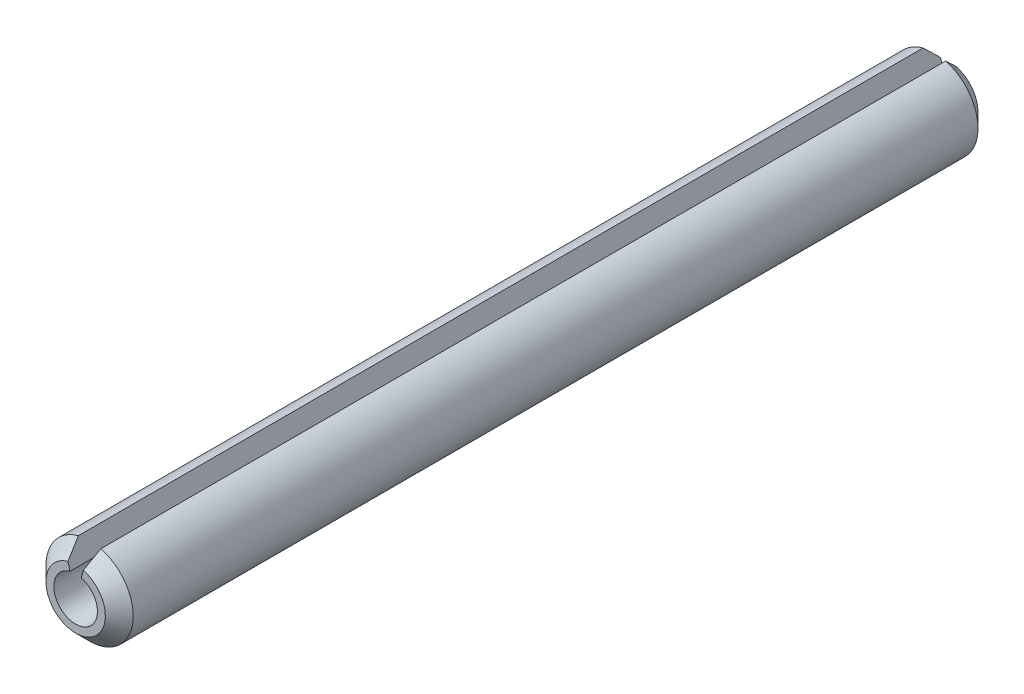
SolidWorks part; units mm, degrees
ref_plane "Front Plane" through (0, 0, 0) normal (0, 0, 1) x (1, 0, 0)
ref_plane "Top Plane" through (0, 0, 0) normal (0, 1, 0) x (1, 0, 0)
ref_plane "Right Plane" through (0, 0, 0) normal (1, 0, 0) x (0, 0, -1)
sketch "Sketch1" plane through (0, 0, 0) normal (0, 0, 1) x (1, 0, 0)
  line L0 (0.2054, 0.7667) -> (0.4109, 1.5334)
  line L1 (-0.2054, 0.7667) -> (-0.4109, 1.5334)
  line L2 (0, 0) -> (0, 2.5064) construction
  arc A0 (-0.4109, 1.5334) -> (0.4109, 1.5334) centre (0, 0) ccw
  arc A1 (-0.2054, 0.7667) -> (0.2054, 0.7667) centre (0, 0) ccw
  dimension "D1" = 3.175
  dimension "D2" = 1.5875
  dimension "D3" = 30
extrude "Extrude1" add sketch "Sketch1" along normal mid plane 31.75
chamfer "Chamfer1" distance 0.508 angle 45 2 edges at (0, -1.5875, -15.875) (0, -1.5875, 15.875)
